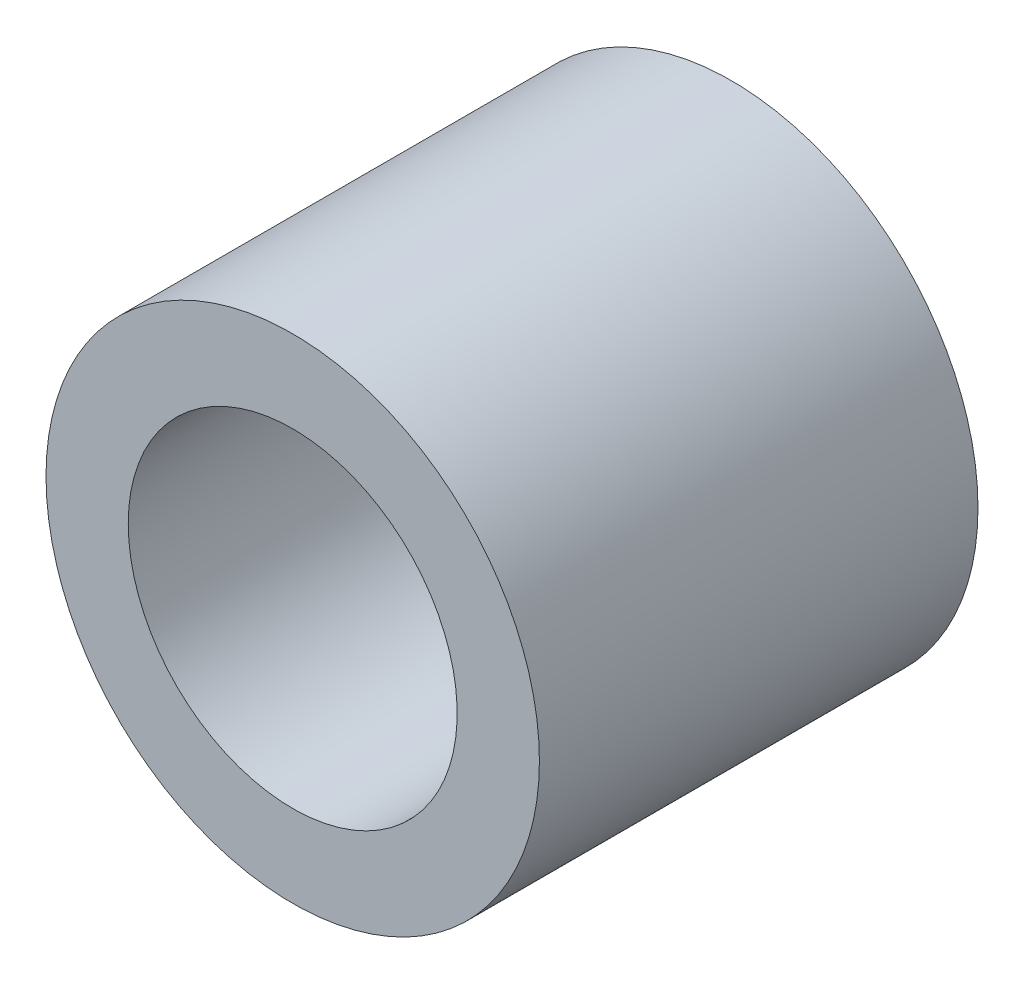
SolidWorks part; units mm, degrees
ref_plane "Face" through (0, 0, 0) normal (0, 0, 1) x (1, 0, 0)
ref_plane "Dessus" through (0, 0, 0) normal (0, 1, 0) x (1, 0, 0)
ref_plane "Droite" through (0, 0, 0) normal (1, 0, 0) x (0, 0, -1)
sketch "Esquisse1" plane through (0, 0, 0) normal (0, 0, 1) x (1, 0, 0)
  circle A0 centre (0, 0) radius 9
  circle A1 centre (0, 0) radius 6
  dimension "D1" = 18
  dimension "D2" = 12
extrude "Base-Extrusion" add sketch "Esquisse1" along normal blind 16
